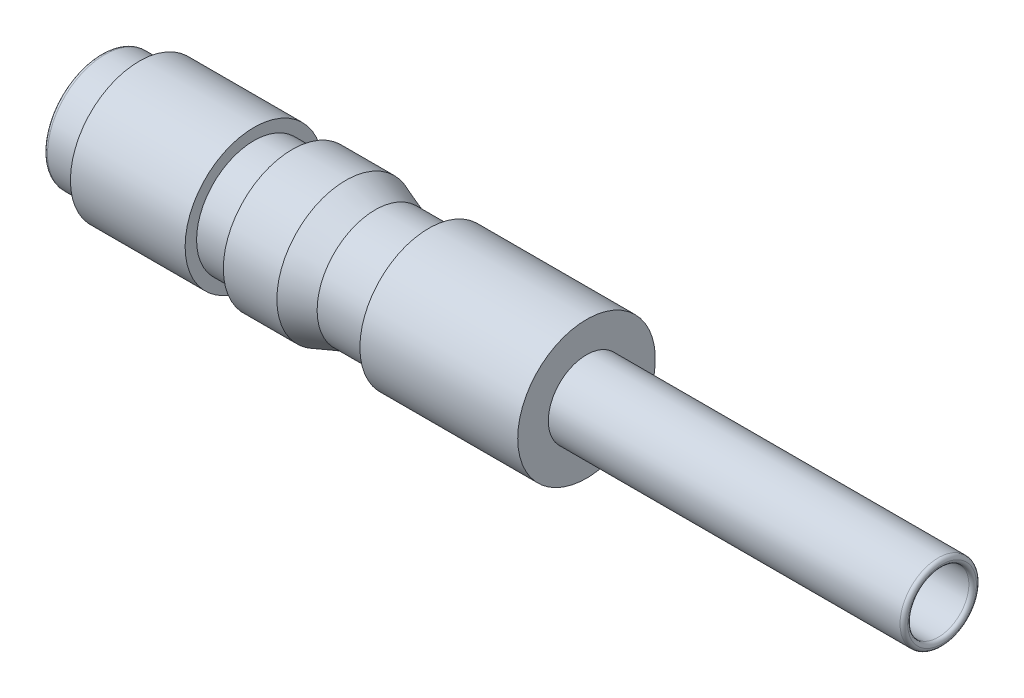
SolidWorks part; units mm, degrees
ref_plane "Plan de face" through (0, 0, 0) normal (0, 0, 1) x (1, 0, 0)
ref_plane "Plan de dessus" through (0, 0, 0) normal (0, 1, 0) x (1, 0, 0)
ref_plane "Plan de droite" through (0, 0, 0) normal (1, 0, 0) x (0, 0, -1)
sketch "Esquisse1" plane through (0, 0, 0) normal (0, 0, 1) x (1, 0, 0)
  line L0 (-4.9975, 0) -> (7.0625, 0) construction
  line L1 (0, 0) -> (0, 0.75)
  line L2 (0, 0.75) -> (0.5, 0.75)
  line L3 (0.5, 0.75) -> (0.5, 0.9)
  line L4 (0.5, 0.9) -> (2, 0.9)
  line L5 (6.35, 0.9) -> (6.35, 0.5)
  line L6 (6.35, 0.5) -> (11, 0.5)
  line L7 (11, 0.5) -> (11, 0)
  line L8 (11, 0) -> (0, 0)
  line L9 (2, 0.9) -> (2, 0.75)
  line L10 (2, 0.75) -> (2.5, 0.75)
  line L11 (2.5, 0.75) -> (2.5, 0.9)
  line L12 (2.5, 0.9) -> (3.2, 0.9)
  line L13 (3.2, 0.9) -> (3.586, 0.7595)
  line L14 (3.586, 0.7595) -> (4.286, 0.7595)
  line L15 (4.286, 0.7595) -> (4.286, 0.9)
  line L16 (4.286, 0.9) -> (6.35, 0.9)
  dimension "D1" = 0.75
  dimension "D2" = 1.5
  dimension "D3" = 0.5
  dimension "D4" = 0.5
  dimension "D5" = 4.65
  dimension "D6" = 11
  dimension "D7" = 0.5
  dimension "D8" = 0.7
  dimension "D9" = 0.7
  dimension "D10" = 2.064
  dimension "D11" = 160
  dimension "D12" = 0.9
  dimension "D13" = 0.75
  dimension "D14" = 0.9
  dimension "D15" = 0.9
revolve "Révolution1" add sketch "Esquisse1" angle 360 about L0
sketch "Esquisse2" plane through (11, 0, 0) normal (1, 0, 0) x (0, 0, -1)
  circle A0 centre (0, 0) radius 0.4
  dimension "D1" = 0.8
extrude "Enlèv. mat.-Extru.1" cut sketch "Esquisse2" against normal blind 6
sketch "Esquisse5" plane through (0, 0, 0) normal (-1, 0, 0) x (0, 0, 1)
  circle A0 centre (0, 0) radius 0.6
  dimension "D1" = 1.2
extrude "Enlèv. mat.-Extru.3" cut sketch "Esquisse5" against normal blind 6
fillet "Congé10" radius 0.05 2 edges at (11, 0, -0.4) (11, 0, 0.5)
fillet "Congé7" radius 0.05 1 edges at (0.5, 0, 0.75)
fillet "Congé8" radius 0.05 1 edges at (0, 0, 0.75)
